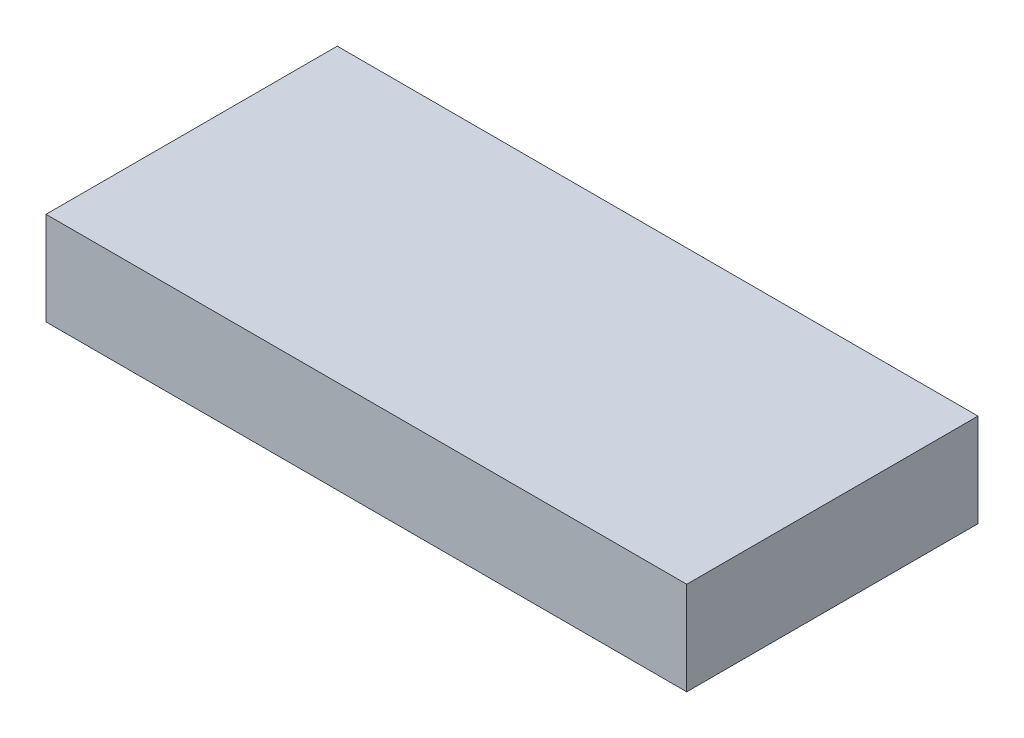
SolidWorks part; units mm, degrees
ref_plane "Front Plane" through (0, 0, 0) normal (0, 0, 1) x (1, 0, 0)
ref_plane "Top Plane" through (0, 0, 0) normal (0, 1, 0) x (1, 0, 0)
ref_plane "Right Plane" through (0, 0, 0) normal (1, 0, 0) x (0, 0, -1)
sketch "Sketch2" plane through (0, 0, 0) normal (0, 1, 0) x (1, 0, 0)
  line L1 (0, 0) -> (-110, 0)
  line L2 (0, 0) -> (0, 50)
  line L3 (0, 50) -> (-110, 50)
  line L4 (-110, 0) -> (-110, 50)
  dimension "D1" = 110
  dimension "D2" = 50
extrude "Boss-Extrude2" add sketch "Sketch2" along normal blind 16
